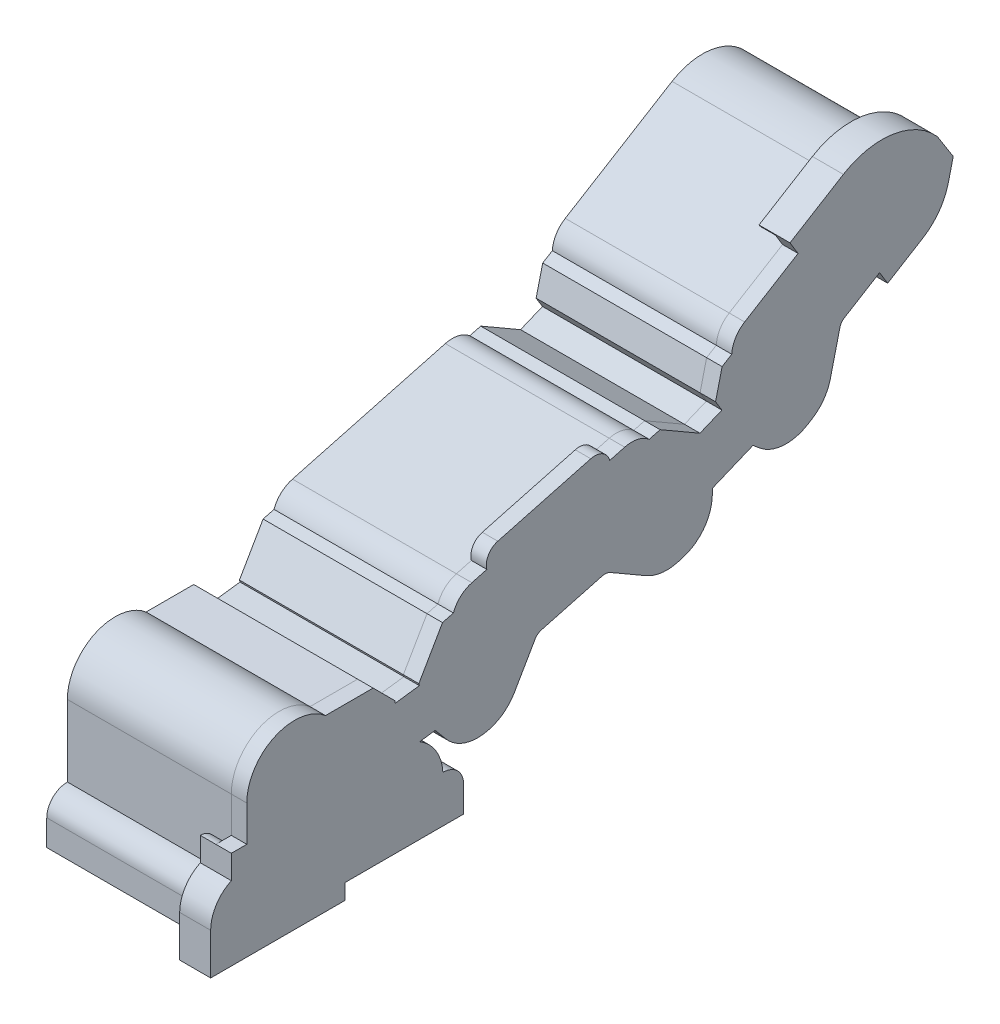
SolidWorks part; units mm, degrees
other "<shell_ff>-<Contouring>"
other "<shell_ff>-<Union>"
ref_plane "Front Plane" through (0, 0, 0) normal (0, 0, 1) x (1, 0, 0)
ref_plane "Top Plane" through (0, 0, 0) normal (0, 1, 0) x (1, 0, 0)
ref_plane "Right Plane" through (0, 0, 0) normal (1, 0, 0) x (0, 0, -1)
inserted part "shell_ff"
sketch "Sketch1" plane through (15.875, 0, 0) normal (1, 0, 0) x (0, 0, -1)
  line L35 (102.741, 47.8696) -> (82.0558, 35.2325)
  line L36 (79.5522, 31.0663) -> (77.6883, 29.9276)
  line L37 (77.6883, 29.9276) -> (76.4172, 24.6646)
  line L38 (76.4172, 24.6646) -> (77.6453, 22.6543)
  line L39 (77.6453, 22.6543) -> (73.3989, 20.8954)
  line L40 (73.3989, 20.8954) -> (65.6791, 25.3525)
  line L41 (65.6791, 25.3525) -> (63.5693, 24.7872)
  line L42 (58.8253, 25.8454) -> (29.2214, 17.9131)
  line L43 (25.6421, 14.6246) -> (23.5324, 14.0593)
  line L44 (23.5324, 14.0593) -> (18.9471, 6.1173)
  line L45 (18.9471, 6.1173) -> (19.0506, 5.7309)
  line L46 (19.0506, 5.7309) -> (14.375, 5.1153)
  line L47 (14.375, 5.1153) -> (14.375, 5.5154)
  line L48 (14.375, 5.5154) -> (10.0904, 9.8)
  line L49 (10.0904, 9.8) -> (0.8633, 9.8)
  line L50 (-14.375, 2.75) -> (-14.375, -11.1005)
  line L51 (-18.375, -15.1005) -> (-18.375, -20.1005)
  line L52 (-18.375, -20.1005) -> (27.625, -20.1005)
  line L53 (27.625, -20.1005) -> (27.625, -15.1005)
  line L54 (23.625, -11.1005) -> (23.6086, -11.1005)
  line L55 (19.1069, -3.7025) -> (22.1192, -3.3059)
  line L56 (22.1192, -3.3059) -> (24.2215, -5.8151)
  line L57 (32.4243, -8.4048) -> (32.588, -8.3609)
  line L58 (37.4457, -4.6335) -> (41.4617, 2.3225)
  line L59 (42.6761, 3.2543) -> (54.5026, 6.4232)
  line L60 (56.0202, 6.2234) -> (62.9762, 2.2074)
  line L61 (69.0467, 1.4082) -> (69.8414, 1.6211)
  line L62 (75.7557, 8.8571) -> (75.8558, 10.4828)
  line L63 (75.8558, 10.4828) -> (83.6693, 13.7193)
  line L64 (83.6693, 13.7193) -> (84.9456, 12.6437)
  line L65 (94.2716, 11.9344) -> (95.0333, 12.3997)
  line L66 (98.639, 17.3484) -> (100.5002, 25.0546)
  line L67 (101.4017, 26.2918) -> (114.9749, 34.5841)
  line L68 (118.5807, 39.5327) -> (119.2429, 42.2748)
  line L69 (119.2429, 42.2748) -> (116.9789, 45.8438)
  line L70 (102.741, 47.8696) -> (82.0558, 35.2325)
  line L71 (79.5522, 31.0663) -> (77.6883, 29.9276)
  line L72 (77.6883, 29.9276) -> (76.4172, 24.6646)
  line L73 (76.4172, 24.6646) -> (77.6453, 22.6543)
  line L74 (77.6453, 22.6543) -> (73.3989, 20.8954)
  line L75 (73.3989, 20.8954) -> (65.6791, 25.3525)
  line L76 (65.6791, 25.3525) -> (63.5693, 24.7872)
  line L77 (58.8253, 25.8454) -> (29.2214, 17.9131)
  line L78 (25.6421, 14.6246) -> (23.5324, 14.0593)
  line L79 (23.5324, 14.0593) -> (18.9471, 6.1173)
  line L80 (18.9471, 6.1173) -> (19.0506, 5.7309)
  line L81 (19.0506, 5.7309) -> (14.375, 5.1153)
  line L82 (14.375, 5.1153) -> (14.375, 5.5154)
  line L83 (14.375, 5.5154) -> (10.0904, 9.8)
  line L84 (10.0904, 9.8) -> (0.8633, 9.8)
  line L85 (-14.375, 2.75) -> (-14.375, -11.1005)
  line L86 (-18.375, -15.1005) -> (-18.375, -20.1005)
  line L87 (-18.375, -20.1005) -> (27.625, -20.1005)
  line L88 (27.625, -20.1005) -> (27.625, -15.1005)
  line L89 (23.625, -11.1005) -> (23.6086, -11.1005)
  line L90 (19.1069, -3.7025) -> (22.1192, -3.3059)
  line L91 (22.1192, -3.3059) -> (24.2215, -5.8151)
  line L92 (32.4243, -8.4048) -> (32.588, -8.3609)
  line L93 (37.4457, -4.6335) -> (41.4617, 2.3225)
  line L94 (42.6761, 3.2543) -> (54.5026, 6.4232)
  line L95 (56.0202, 6.2234) -> (62.9762, 2.2074)
  line L96 (69.0467, 1.4082) -> (69.8414, 1.6211)
  line L97 (75.7557, 8.8571) -> (75.8558, 10.4828)
  line L98 (75.8558, 10.4828) -> (83.6693, 13.7193)
  line L99 (83.6693, 13.7193) -> (84.9456, 12.6437)
  line L100 (94.2716, 11.9344) -> (95.0333, 12.3997)
  line L101 (98.639, 17.3484) -> (100.5002, 25.0546)
  line L102 (101.4017, 26.2918) -> (114.9749, 34.5841)
  line L103 (118.5807, 39.5327) -> (119.2429, 42.2748)
  line L104 (119.2429, 42.2748) -> (116.9789, 45.8438)
  arc A18 (82.0558, 35.2325) -> (79.5522, 31.0663) centre (84.7928, 30.7524) ccw
  arc A19 (63.5693, 24.7872) -> (58.8253, 25.8454) centre (60.1841, 20.7743) ccw
  arc A20 (29.2214, 17.9131) -> (25.6421, 14.6246) centre (30.5802, 12.8419) ccw
  arc A21 (0.8633, 9.8) -> (-14.375, 2.75) centre (-5.125, 2.75) ccw
  arc A22 (-14.375, -11.1005) -> (-18.375, -15.1005) centre (-14.375, -15.1005) ccw
  arc A23 (27.625, -15.1005) -> (23.625, -11.1005) centre (23.625, -15.1005) ccw
  arc A24 (23.6086, -11.1005) -> (19.1069, -3.7025) centre (14.375, -11.6505) ccw
  arc A25 (24.2215, -5.8151) -> (32.4243, -8.4048) centre (30.3537, -0.6773) ccw
  arc A26 (32.588, -8.3609) -> (37.4457, -4.6335) centre (30.5175, -0.6335) ccw
  arc A27 (42.6761, 3.2543) -> (41.4617, 2.3225) centre (43.1937, 1.3225) ccw
  arc A28 (56.0202, 6.2234) -> (54.5026, 6.4232) centre (55.0202, 4.4914) ccw
  arc A29 (62.9762, 2.2074) -> (69.0467, 1.4082) centre (66.9762, 9.1356) ccw
  arc A30 (69.8414, 1.6211) -> (75.7557, 8.8571) centre (67.7708, 9.3485) ccw
  arc A31 (84.9456, 12.6437) -> (94.2716, 11.9344) centre (90.1009, 18.7612) ccw
  arc A32 (95.0333, 12.3997) -> (98.639, 17.3484) centre (90.8626, 19.2265) ccw
  arc A33 (101.4017, 26.2918) -> (100.5002, 25.0546) centre (102.4443, 24.5851) ccw
  arc A34 (114.9749, 34.5841) -> (118.5807, 39.5327) centre (110.8043, 41.4109) ccw
  arc A35 (116.9789, 45.8438) -> (102.741, 47.8696) centre (108.632, 38.2267) ccw
  arc A36 (82.0558, 35.2325) -> (79.5522, 31.0663) centre (84.7928, 30.7524) ccw
  arc A37 (63.5693, 24.7872) -> (58.8253, 25.8454) centre (60.1841, 20.7743) ccw
  arc A38 (29.2214, 17.9131) -> (25.6421, 14.6246) centre (30.5802, 12.8419) ccw
  arc A39 (0.8633, 9.8) -> (-14.375, 2.75) centre (-5.125, 2.75) ccw
  arc A40 (-14.375, -11.1005) -> (-18.375, -15.1005) centre (-14.375, -15.1005) ccw
  arc A41 (27.625, -15.1005) -> (23.625, -11.1005) centre (23.625, -15.1005) ccw
  arc A42 (23.6086, -11.1005) -> (19.1069, -3.7025) centre (14.375, -11.6505) ccw
  arc A43 (24.2215, -5.8151) -> (32.4243, -8.4048) centre (30.3537, -0.6773) ccw
  arc A44 (32.588, -8.3609) -> (37.4457, -4.6335) centre (30.5175, -0.6335) ccw
  arc A45 (42.6761, 3.2543) -> (41.4617, 2.3225) centre (43.1937, 1.3225) ccw
  arc A46 (56.0202, 6.2234) -> (54.5026, 6.4232) centre (55.0202, 4.4914) ccw
  arc A47 (62.9762, 2.2074) -> (69.0467, 1.4082) centre (66.9762, 9.1356) ccw
  arc A48 (69.8414, 1.6211) -> (75.7557, 8.8571) centre (67.7708, 9.3485) ccw
  arc A49 (84.9456, 12.6437) -> (94.2716, 11.9344) centre (90.1009, 18.7612) ccw
  arc A50 (95.0333, 12.3997) -> (98.639, 17.3484) centre (90.8626, 19.2265) ccw
  arc A51 (101.4017, 26.2918) -> (100.5002, 25.0546) centre (102.4443, 24.5851) ccw
  arc A52 (114.9749, 34.5841) -> (118.5807, 39.5327) centre (110.8043, 41.4109) ccw
  arc A53 (116.9789, 45.8438) -> (102.741, 47.8696) centre (108.632, 38.2267) ccw
  dimension "D1" = 0
extrude "Base" add sketch "Sketch1" along normal blind 3 separate body
sketch "Sketch2" plane through (18.875, 0, 0) normal (1, 0, 0) x (0, 0, -1)
  line L0 (102.741, 47.8696) -> (82.0558, 35.2325) construction
  line L1 (119.2429, 42.2748) -> (116.9789, 45.8438) construction
  line L2 (118.5807, 39.5327) -> (119.2429, 42.2748) construction
  line L3 (101.4017, 26.2918) -> (114.9749, 34.5841) construction
  line L4 (102.741, 47.8696) -> (82.0558, 35.2325) construction
  line L5 (119.2429, 42.2748) -> (116.9789, 45.8438)
  line L6 (118.5807, 39.5327) -> (119.2429, 42.2748)
  line L7 (101.4017, 26.2918) -> (114.9749, 34.5841) construction
  line L8 (-18.375, -15.1005) -> (-18.375, -20.1005) construction
  line L9 (-18.375, -20.1005) -> (27.625, -20.1005) construction
  line L10 (-14.375, 2.75) -> (-14.375, -11.1005) construction
  line L11 (-18.375, -15.1005) -> (-18.375, -20.1005)
  line L12 (-18.375, -20.1005) -> (4.625, -20.1005)
  line L13 (-14.375, -4.1753) -> (-14.375, -11.1005)
  line L14 (-14.375, -4.1753) -> (4.625, -20.1005) construction
  line L15 (-18.375, -20.1005) -> (27.625, -20.1005) construction
  line L16 (-14.375, 2.75) -> (-14.375, -11.1005) construction
  line L17 (92.3984, 41.5511) -> (108.1883, 30.4379) construction
  line L18 (92.3984, 41.5511) -> (102.741, 47.8696)
  line L19 (108.1883, 30.4379) -> (114.9749, 34.5841)
  line L20 (90.8344, 44.1111) -> (101.1769, 50.4297)
  line L21 (122.4578, 42.8073) -> (119.38, 47.6592)
  line L22 (121.4968, 38.8284) -> (122.4578, 42.8073)
  line L23 (109.7523, 27.8779) -> (116.539, 32.024)
  line L24 (90.8344, 44.1111) -> (92.3984, 41.5511)
  line L25 (109.7523, 27.8779) -> (108.1883, 30.4379)
  line L26 (-17.375, -4.1753) -> (-17.375, -8.776)
  line L27 (-21.375, -15.1005) -> (-21.375, -23.1005)
  line L28 (-21.375, -23.1005) -> (4.625, -23.1005)
  line L29 (-17.375, -4.1753) -> (-14.375, -4.1753)
  line L30 (4.625, -20.1005) -> (4.625, -23.1005)
  arc A0 (116.9789, 45.8438) -> (102.741, 47.8696) centre (108.632, 38.2267) ccw construction
  arc A1 (114.9749, 34.5841) -> (118.5807, 39.5327) centre (110.8043, 41.4109) ccw construction
  arc A2 (116.9789, 45.8438) -> (102.741, 47.8696) centre (108.632, 38.2267) ccw
  arc A3 (114.9749, 34.5841) -> (118.5807, 39.5327) centre (110.8043, 41.4109) ccw
  arc A4 (-14.375, -11.1005) -> (-18.375, -15.1005) centre (-14.375, -15.1005) ccw construction
  arc A5 (-14.375, -11.1005) -> (-18.375, -15.1005) centre (-14.375, -15.1005) ccw
  arc A6 (119.38, 47.6592) -> (101.1769, 50.4297) centre (108.632, 38.2267) ccw
  arc A7 (116.539, 32.024) -> (121.4968, 38.8284) centre (110.8043, 41.4109) ccw
  arc A8 (-17.375, -8.776) -> (-21.375, -15.1005) centre (-14.375, -15.1005) ccw
  dimension "D1" = 3
  dimension "D2" = 3
extrude "Walls" add sketch "Sketch2" against normal blind 6
sketch "Sketch3" plane through (15.875, 0, 0) normal (-1, 0, 0) x (0, 0, 1)
  line L0 (-32.1192, 18.6895) -> (-55.9276, 25.0689)
  line L1 (-58.8253, 25.8454) -> (-29.2214, 17.9131) construction
  line L2 (-55.9276, 25.0689) -> (-55.1511, 27.9667)
  line L3 (-55.1511, 27.9667) -> (-31.3427, 21.5873)
  line L4 (-31.3427, 21.5873) -> (-32.1192, 18.6895)
  dimension "D1" = 3
  dimension "D2" = 3
  dimension "D3" = 3
extrude "Helper Tab" add sketch "Sketch3" against normal up to surface (3 mm away)
fillet "Contouring" radius 3 6 edges at (14.375, -4.1753, 14.375) (14.375, -20.1005, -4.625) (14.375, 30.4379, -108.1883) (14.375, 41.5511, -92.3984) (17.375, 27.9667, -55.1511) (17.375, 21.5873, -31.3427)
ref_point "Ref Center"
equation "\"D1@Sketch2\"=\"width keep@values@params_print.sldprt\""
equation "\"D2@Sketch2\"=\"D1@Sketch2\""
equation "\"D1@Walls\"=2*\"width keep@values@params_print.sldprt\""
equation "\"D1@Sketch3\"=\"width keep@values@params_print.sldprt\""
equation "\"D2@Sketch3\"=\"D1@Sketch3\""
equation "\"D3@Sketch3\"=\"D1@Sketch3\""
